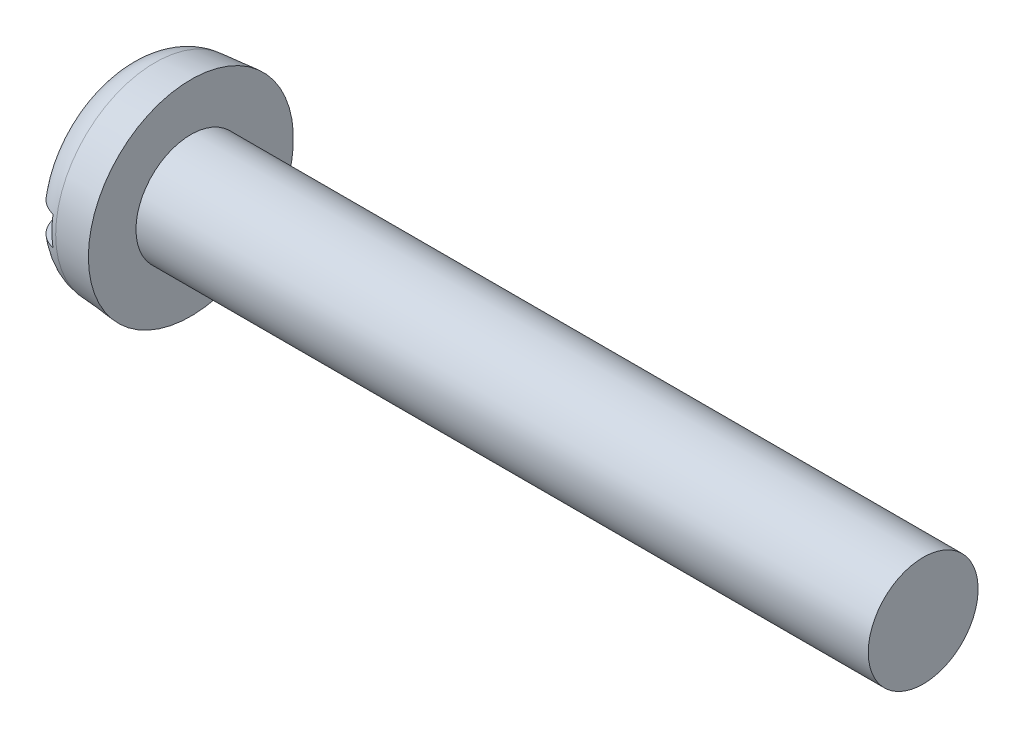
SolidWorks part; units mm, degrees
ref_plane "Plane1" through (0, 0, 0) normal (0, 0, 1) x (1, 0, 0)
ref_plane "Plane2" through (0, 0, 0) normal (0, 1, 0) x (1, 0, 0)
ref_plane "Plane3" through (0, 0, 0) normal (1, 0, 0) x (0, 0, -1)
sketch "BodySke" plane through (0, 0, 0) normal (0, 0, 1) x (1, 0, 0)
  line L0 (1.8, 1.5) -> (1.8, 2.8)
  line L1 (0, 0) -> (0, 2.6425)
  line L2 (-25.4, 0) -> (127, 0) construction
  line L3 (21.8, 0) -> (0, 0)
  line L4 (1.8, 1.5) -> (21.8, 1.5)
  line L5 (21.8, 1.5) -> (21.8, 0)
  line L6 (0, 2.6425) -> (1.8, 2.8)
  line L9 (2.3, 3.0875) -> (2.3, -6.4375) construction
  line L10 (1.8, 6.35) -> (1.8, -3.175) construction
  dimension "Head_ht" = 1.8
  dimension "Diameter" = 3
  dimension "Length" = 20
  dimension "Head_dia" = 5.6
  dimension "Advance" = 0.5
  dimension "Thread_nom" = 20
  dimension "Head_side_angle" = 5
revolve "Base-Revolve" add sketch "BodySke" angle 360 about L2
fillet "Fillet1" [suppressed] radius 0.1
fillet "Fillet2" radius 0.9 1 edges at (0, 0, 2.6425)
sketch "Sketch2" plane through (0, 0, 0) normal (1, 0, 0) x (0, 0, -1)
  line L0 (2.8, -0.4) -> (-2.8, -0.4)
  line L1 (2.8, -0.4) -> (2.8, 0.4)
  line L2 (-2.8, 0.4) -> (2.8, 0.4)
  line L3 (-2.8, 0.4) -> (-2.8, -0.4)
  dimension "D1" = 5.6
  dimension "D2" = 2.8
  dimension "Slot_width" = 0.8
  dimension "D3" = 0.4
extrude "Slot" cut sketch "Sketch2" along normal blind 0.7
sketch "ThdSchSke" plane through (0, 0, 0) normal (0, 0, 1) x (1, 0, 0)
  line L0 (2.8, -1.2195) -> (2.6036, -1.5)
  line L1 (2.8, -1.2195) -> (2.9964, -1.5)
  line L2 (2.9964, -1.5) -> (2.9964, -1.875)
  line L3 (-3.175, 0) -> (5.1513, 0) construction
  line L5 (2.9964, -1.875) -> (2.6036, -1.875)
  line L6 (2.6036, -1.875) -> (2.6036, -1.5)
  dimension "Thread_minor" = 2.439
  dimension "Diameter" = 3
  dimension "Start" = 2.8
  dimension "SideAngle" = 55
  dimension "VeeAngle" = 70
  dimension "Overcut" = 3.75
revolve "ThreadSchematic" [suppressed] cut sketch "ThdSchSke" angle 360 about L3
pattern_linear "ThdSchPat" [suppressed]
equation "\"D1@Sketch2\" = \"Head_dia@BodySke\""
equation "\"D2@Sketch2\" = \"D1@Sketch2\" / 2"
equation "\"D3@Sketch2\" = \"Slot_width@Sketch2\" / 2"
equation "\"Thread_length@ThreadCosmetic\" = ((sgn( (\"Length@BodySke\" - \"Advance@BodySke\" * 2.0 ) - \"Thread_nom@BodySke\" )-1)*( (\"Length@BodySke\" - \"Advance@BodySke\"  * 2.0) - \"Thread_nom@BodySke\" ))/-2+ \"Thread_"
equation "\"Thread_minor@ThdSchSke\" = \"Thread_minor@ThreadCosmetic\""
equation "\"Diameter@ThdSchSke\" = \"Diameter@BodySke\""
equation "\"Overcut@ThdSchSke\" = \"Diameter@BodySke\" * 1.25"
equation "\"Start@ThdSchSke\" = \"Head_ht@BodySke\" + \"Length@BodySke\" - \"Thread_length@ThreadCosmetic\"  '---Non-countersunk---"
equation "\"Num_threads@ThdSchPat\" = int( \"Thread_length@ThreadCosmetic\" / \"Advance@BodySke\" + 0.999 )  + 1"
equation "\"Advance@ThdSchPat\" = \"Thread_length@ThreadCosmetic\" /  (\"Num_threads@ThdSchPat\" - 1) 'relax it"
